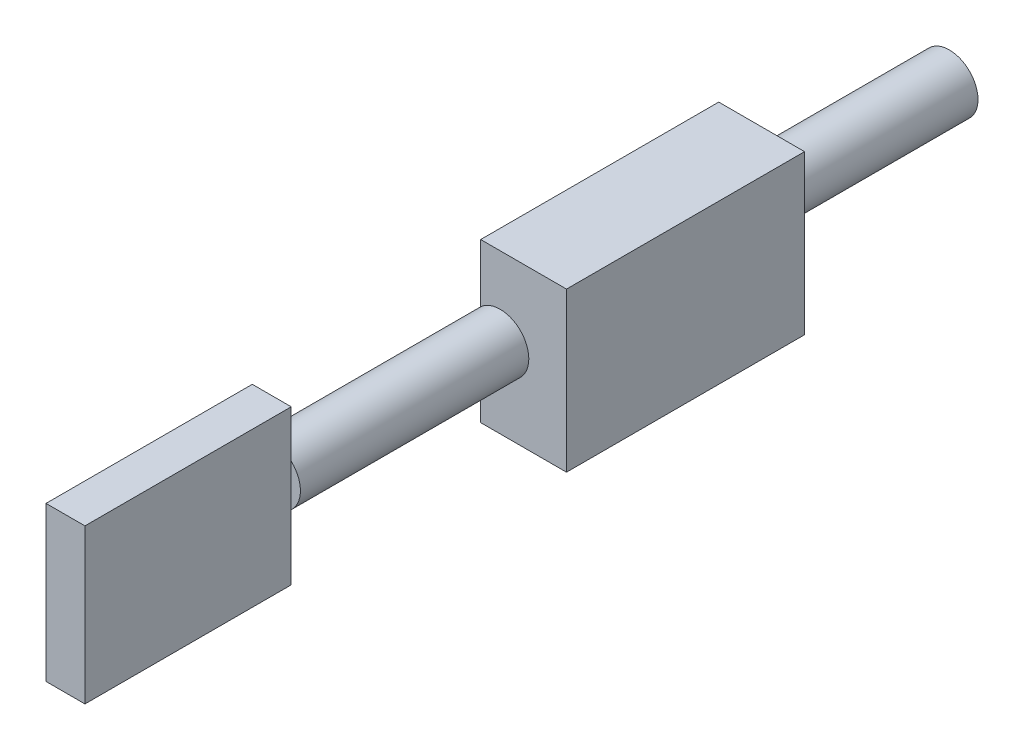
SolidWorks part; units mm, degrees
ref_plane "Front Plane" through (0, 0, 0) normal (0, 0, 1) x (1, 0, 0)
ref_plane "Top Plane" through (0, 0, 0) normal (0, 1, 0) x (1, 0, 0)
ref_plane "Right Plane" through (0, 0, 0) normal (1, 0, 0) x (0, 0, -1)
sketch "Sketch1" plane through (0, 0, 0) normal (1, 0, 0) x (0, 0, -1)
  line L0 (0, 0) -> (-108.73, 0) construction
  line L1 (-141.83, 10.93) -> (-108.73, 10.93)
  line L2 (-141.83, 10.93) -> (-141.83, -13.82)
  line L3 (-141.83, -13.82) -> (-108.73, -13.82)
  line L4 (-108.73, 10.93) -> (-108.73, -13.82)
  line L5 (-72.08, 12.725) -> (-33.88, 12.725)
  line L6 (-72.08, 12.725) -> (-72.08, -12.725)
  line L7 (-72.08, -12.725) -> (-33.88, -12.725)
  line L8 (-33.88, 12.725) -> (-33.88, -12.725)
  line L9 (0, 31.8577) -> (0, -31.8577) construction
  point P15 (0, 0)
  point P16 (-33.88, 0)
  dimension "D1" = 38.2
  dimension "D2" = 25.45
  dimension "D3" = 33.88
  dimension "D4" = 10.93
  dimension "D5" = 24.75
  dimension "D6" = 36.65
  dimension "D7" = 33.1
extrude "Boss-Extrude1" add sketch "Sketch1" along normal mid plane 6.25
sketch "Sketch2" plane through (-3.125, 0, 0) normal (-1, 0, 0) x (0, 0, 1)
  line L1 (33.88, 12.725) -> (72.08, 12.725)
  line L2 (33.88, 12.725) -> (33.88, -12.725)
  line L3 (33.88, -12.725) -> (72.08, -12.725)
  line L4 (72.08, 12.725) -> (72.08, -12.725)
extrude "Boss-Extrude2" add sketch "Sketch2" against normal offset from surface (7.525 mm away) 10.65 from surface at -6.25
sketch "Sketch3" plane through (0, 0, 0) normal (0, 0, 1) x (1, 0, 0)
  circle A0 centre (0, 0) radius 4.6
  dimension "D1" = 9.2
extrude "Boss-Extrude3" add sketch "Sketch3" along normal up to surface (108.73 mm away)
